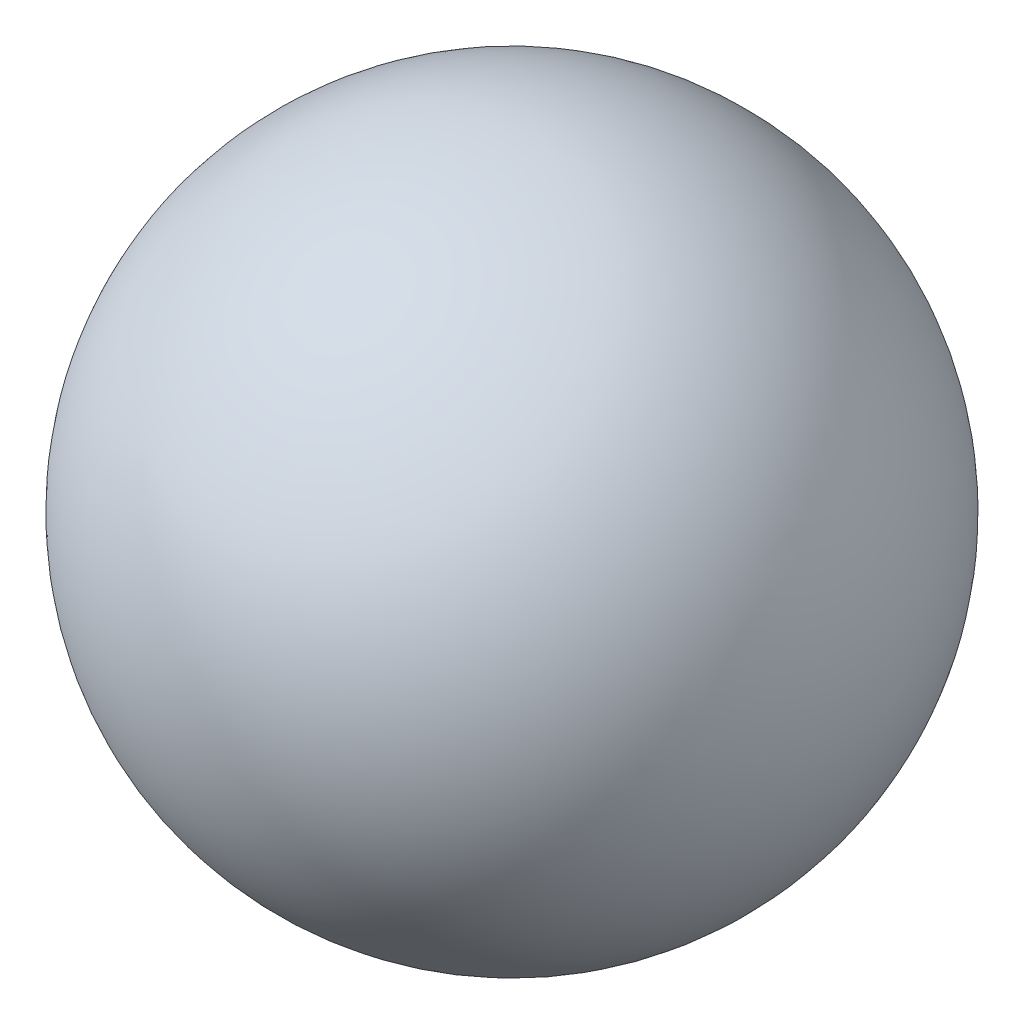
SolidWorks part; units mm, degrees
ref_plane "Plan1" through (0, 0, 0) normal (0, 0, 1) x (1, 0, 0)
ref_plane "Plan2" through (0, 0, 0) normal (0, 1, 0) x (1, 0, 0)
ref_plane "Plan3" through (0, 0, 0) normal (1, 0, 0) x (0, 0, -1)
sketch "Esquisse1" plane through (0, 0, 0) normal (0, 0, 1) x (1, 0, 0)
  line L0 (7.25, 10) -> (13.25, 10)
  line L1 (5.3121, 10) -> (14.6585, 10) construction
  line L2 (-1.3797, 10) -> (7.6349, 10) construction
  arc A0 (7.25, 10) -> (13.25, 10) centre (10.25, 10) ccw
  arc A1 (7.6519, 8.5) -> (12.8481, 8.5) centre (10.25, 10) ccw construction
revolve "Base-Révolution" add sketch "Esquisse1" angle 360 about L1
sketch "Esq_WRNL_Compact001" plane through (0, 0, 0) normal (0, 0, 1) x (1, 0, 0)
  line L0 (6.25, 6) -> (6.25, 14)
  line L1 (14.25, 6) -> (14.25, 14)
  line L2 (6.25, 6) -> (14.25, 6)
  line L3 (6.25, 14) -> (14.25, 14)
